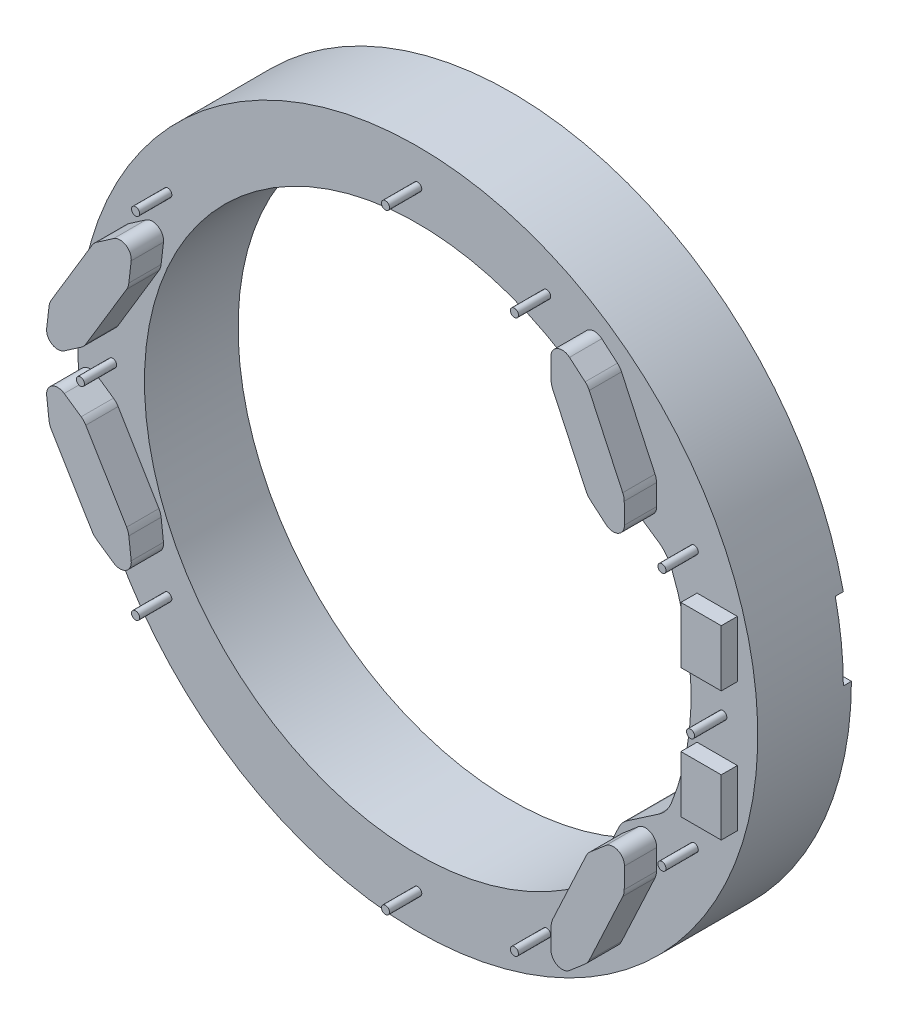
SolidWorks part; units mm, degrees
ref_plane "Front Plane" through (0, 0, 0) normal (0, 0, 1) x (1, 0, 0)
ref_plane "Top Plane" through (0, 0, 0) normal (0, 1, 0) x (1, 0, 0)
ref_plane "Right Plane" through (0, 0, 0) normal (1, 0, 0) x (0, 0, -1)
sketch "Sketch1" plane through (0, 0, 0) normal (0, 0, 1) x (1, 0, 0)
  line L0 (27.9645, -32.5157) -> (32.0997, -23.6476) construction
  line L1 (33.194, -22.3583) -> (38.1749, -18.9531) construction
  line L2 (27.9645, 32.5157) -> (32.0997, 23.6476) construction
  line L3 (33.194, 22.3583) -> (38.1749, 18.9531) construction
  line L4 (37.8927, 18.5404) -> (32.9118, 21.9456)
  line L5 (31.6466, 23.4363) -> (27.5113, 32.3044)
  line L6 (27.5113, -32.3044) -> (31.6466, -23.4363)
  line L7 (32.9118, -21.9456) -> (37.8927, -18.5404)
  line L32 (27.9645, -32.5157) -> (32.0997, -23.6476) construction
  line L33 (33.194, -22.3583) -> (38.1749, -18.9531) construction
  line L34 (38.1749, 18.9531) -> (33.194, 22.3583) construction
  line L35 (32.0997, 23.6476) -> (27.9645, 32.5157) construction
  circle A0 centre (0, 0) radius 53.5
  arc A1 (31.9213, -42.9335) -> (31.9213, 42.9335) centre (0, 0) ccw construction
  arc A2 (39.891, -16.0533) -> (39.891, 16.0533) centre (0, 0) ccw
  arc A3 (-10.1662, 42.2954) -> (-10.1662, -42.2954) centre (0, 0) ccw construction
  arc A4 (40.3548, -16.24) -> (40.3548, 16.24) centre (0, 0) ccw construction
  arc A5 (38.1749, -18.9531) -> (40.3548, -16.24) centre (34.7886, -14) ccw construction
  arc A6 (33.194, -22.3583) -> (32.0997, -23.6476) centre (34.9999, -25) ccw construction
  arc A7 (26.1309, -34.7768) -> (27.9645, -32.5157) centre (22.5266, -29.98) ccw construction
  arc A8 (40.3548, 16.24) -> (38.1749, 18.9531) centre (34.7886, 14) ccw construction
  arc A9 (32.0997, 23.6476) -> (33.194, 22.3583) centre (34.9999, 25) ccw construction
  arc A10 (27.9645, 32.5157) -> (26.1309, 34.7768) centre (22.5266, 29.98) ccw construction
  arc A11 (39.891, 16.0533) -> (37.8927, 18.5404) centre (34.7886, 14) ccw
  arc A12 (31.6466, 23.4363) -> (32.9118, 21.9456) centre (34.9999, 25) ccw
  arc A13 (27.5113, 32.3044) -> (25.8306, 34.3771) centre (22.5266, 29.98) ccw
  arc A14 (25.8306, 34.3771) -> (25.8306, -34.3771) centre (0, 0) ccw
  arc A15 (25.8306, -34.3771) -> (27.5113, -32.3044) centre (22.5266, -29.98) ccw
  arc A16 (32.9118, -21.9456) -> (31.6466, -23.4363) centre (34.9999, -25) ccw
  arc A17 (37.8927, -18.5404) -> (39.891, -16.0533) centre (34.7886, -14) ccw
  arc A73 (26.1309, -34.7768) -> (27.9645, -32.5157) centre (22.5266, -29.98) ccw construction
  arc A74 (33.194, -22.3583) -> (32.0997, -23.6476) centre (34.9999, -25) ccw construction
  arc A75 (38.1749, -18.9531) -> (40.3548, -16.24) centre (34.7886, -14) ccw construction
  arc A76 (40.3548, -16.24) -> (40.3548, 16.24) centre (0, 0) ccw construction
  arc A77 (40.3548, 16.24) -> (38.1749, 18.9531) centre (34.7886, 14) ccw construction
  arc A78 (32.0997, 23.6476) -> (33.194, 22.3583) centre (34.9999, 25) ccw construction
  arc A79 (27.9645, 32.5157) -> (26.1309, 34.7768) centre (22.5266, 29.98) ccw construction
  arc A80 (26.1309, 34.7768) -> (26.1309, -34.7768) centre (0, 0) ccw construction
  dimension "D1" = 0.5
extrude "Boss-Extrude1" add sketch "Sketch1" along normal blind 14.732
sketch "Sketch2" plane through (0, 0, 14.732) normal (0, 0, 1) x (1, 0, 0)
  line L0 (27.8049, 40.4297) -> (35.8347, 23.2099) construction
  line L1 (28.9564, 41.7727) -> (27.8049, 40.4297) construction
  line L2 (27.8049, 40.4297) -> (26.036, 40.4109) construction
  line L3 (-41.7614, 20.644) -> (-51.5471, 4.3579) construction
  line L4 (28.9564, 41.7727) -> (31.4147, 39.6649)
  line L5 (32.0634, 38.8101) -> (37.3313, 27.5131)
  line L6 (35.8347, 23.2099) -> (35.8347, 0) construction
  line L7 (35.8347, 0) -> (0, 0) construction
  line L8 (0, 0) -> (-51.5471, 0) construction
  line L9 (-51.5471, -4.3579) -> (-51.5471, 4.3579) construction
  line L10 (-51.5471, 4.3579) -> (-53.3044, 4.5615) construction
  line L11 (-46.6542, -12.501) -> (-43.9327, -10.8657) construction
  line L12 (-50.5423, -2.9019) -> (-51.5471, -4.3579) construction
  line L13 (-41.7614, -20.644) -> (-40.0041, -20.4404) construction
  line L14 (-42.7662, -22.1) -> (-41.7614, -20.644) construction
  line L15 (-46.6542, -12.501) -> (-49.3757, -14.1362) construction
  line L16 (-51.5471, -4.3579) -> (-53.3044, -4.5615) construction
  line L17 (-53.3044, 4.5615) -> (-52.9316, 7.7782)
  line L18 (-46.6542, 12.501) -> (-49.3757, 14.1362) construction
  line L19 (-52.5856, 8.794) -> (-46.1658, 19.4784)
  line L20 (-45.4313, 20.2607) -> (-42.7662, 22.1)
  line L21 (-42.7662, 22.1) -> (-41.7614, 20.644) construction
  line L22 (-41.7614, 20.644) -> (-40.0041, 20.4404) construction
  line L23 (-40.0041, 20.4404) -> (-40.3769, 17.2237)
  line L24 (-40.7228, 16.2079) -> (-47.1426, 5.5235)
  line L25 (-47.8771, 4.7412) -> (-50.5423, 2.9019)
  line L26 (-50.5423, 2.9019) -> (-51.5471, 4.3579) construction
  line L27 (-46.6542, 12.501) -> (-43.9327, 10.8657) construction
  line L28 (37.5691, 26.4668) -> (37.6036, 23.2287)
  line L29 (26.036, 40.4109) -> (26.0705, 37.1728)
  line L30 (26.3084, 36.1265) -> (31.5762, 24.8295)
  line L31 (32.2249, 23.9747) -> (34.6832, 21.8669)
  line L32 (35.8347, 23.2099) -> (37.6036, 23.2287) construction
  line L33 (35.8347, 23.2099) -> (34.6832, 21.8669) construction
  line L34 (31.8198, 31.8198) -> (34.6973, 33.1616) construction
  line L35 (31.8198, 31.8198) -> (28.9423, 30.478) construction
  line L36 (-41.7614, -20.644) -> (-51.5471, -4.3579) construction
  line L37 (-47.8771, -4.7412) -> (-50.5423, -2.9019)
  line L38 (-40.7228, -16.2079) -> (-47.1426, -5.5235)
  line L39 (-40.0041, -20.4404) -> (-40.3769, -17.2237)
  line L40 (-45.4313, -20.2607) -> (-42.7662, -22.1)
  line L41 (-52.5856, -8.794) -> (-46.1658, -19.4784)
  line L42 (-53.3044, -4.5615) -> (-52.9316, -7.7782)
  line L43 (31.8198, -31.8198) -> (28.9423, -30.478) construction
  line L44 (31.8198, -31.8198) -> (34.6973, -33.1616) construction
  line L45 (35.8347, -23.2099) -> (34.6832, -21.8669) construction
  line L46 (35.8347, -23.2099) -> (37.6036, -23.2287) construction
  line L47 (27.8049, -40.4297) -> (26.036, -40.4109) construction
  line L48 (28.9564, -41.7727) -> (27.8049, -40.4297) construction
  line L49 (27.8049, -40.4297) -> (35.8347, -23.2099) construction
  line L50 (32.2249, -23.9747) -> (34.6832, -21.8669)
  line L51 (26.3084, -36.1265) -> (31.5762, -24.8295)
  line L52 (26.036, -40.4109) -> (26.0705, -37.1728)
  line L53 (37.5691, -26.4668) -> (37.6036, -23.2287)
  line L54 (32.0634, -38.8101) -> (37.3313, -27.5131)
  line L55 (28.9564, -41.7727) -> (31.4147, -39.6649)
  arc A0 (28.9564, 41.7727) -> (26.036, 40.4109) centre (27.8049, 40.4297) ccw
  arc A1 (34.6832, 21.8669) -> (37.6036, 23.2287) centre (35.8347, 23.2099) ccw
  arc A2 (-40.0041, 20.4404) -> (-42.7662, 22.1) centre (-41.7614, 20.644) ccw
  arc A3 (-53.3044, 4.5615) -> (-50.5423, 2.9019) centre (-51.5471, 4.3579) ccw
  circle A4 centre (0, 0) radius 53.5 construction
  arc A6 (-52.9316, 7.7782) -> (-52.5856, 8.794) centre (-50.4084, 7.4858) cw
  arc A10 (-46.1658, -19.4784) -> (-45.4313, -20.2607) centre (-43.9886, -18.1702) ccw
  arc A11 (-40.3769, -17.2237) -> (-40.7228, -16.2079) centre (-42.9, -17.5161) ccw
  arc A12 (-47.1426, -5.5235) -> (-47.8771, -4.7412) centre (-49.3198, -6.8317) ccw
  arc A13 (-52.9316, -7.7782) -> (-52.5856, -8.794) centre (-50.4084, -7.4858) ccw
  arc A14 (-47.1426, 5.5235) -> (-47.8771, 4.7412) centre (-49.3198, 6.8317) cw
  arc A15 (-40.3769, 17.2237) -> (-40.7228, 16.2079) centre (-42.9, 17.5161) cw
  arc A16 (-46.1658, 19.4784) -> (-45.4313, 20.2607) centre (-43.9886, 18.1702) cw
  arc A17 (31.4147, 39.6649) -> (32.0634, 38.8101) centre (29.7614, 37.7366) cw
  arc A18 (37.3313, 27.5131) -> (37.5691, 26.4668) centre (35.0292, 26.4397) cw
  arc A19 (31.5762, 24.8295) -> (32.2249, 23.9747) centre (33.8782, 25.903) ccw
  arc A20 (26.0705, 37.1728) -> (26.3084, 36.1265) centre (28.6104, 37.1999) ccw
  arc A21 (-53.3044, -4.5615) -> (-50.5423, -2.9019) centre (-51.5471, -4.3579) cw
  arc A22 (-40.0041, -20.4404) -> (-42.7662, -22.1) centre (-41.7614, -20.644) cw
  arc A23 (26.0705, -37.1728) -> (26.3084, -36.1265) centre (28.6104, -37.1999) cw
  arc A24 (31.5762, -24.8295) -> (32.2249, -23.9747) centre (33.8782, -25.903) cw
  arc A25 (37.3313, -27.5131) -> (37.5691, -26.4668) centre (35.0292, -26.4397) ccw
  arc A26 (31.4147, -39.6649) -> (32.0634, -38.8101) centre (29.7614, -37.7366) ccw
  arc A27 (34.6832, -21.8669) -> (37.6036, -23.2287) centre (35.8347, -23.2099) cw
  arc A28 (28.9564, -41.7727) -> (26.036, -40.4109) centre (27.8049, -40.4297) cw
  circle A29 centre (27.8049, 40.4297) radius 0.55 construction
  circle A30 centre (35.8347, 23.2099) radius 0.55 construction
  circle A31 centre (-51.5471, 4.3579) radius 0.55 construction
  circle A32 centre (-41.7614, 20.644) radius 0.55 construction
  circle A33 centre (48, 0) radius 0.635
  circle A34 centre (43.5028, 20.2857) radius 0.635
  circle A35 centre (20.2857, 43.5028) radius 0.635
  circle A36 centre (0, 48) radius 0.635
  circle A37 centre (-39.3193, 27.5317) radius 0.635
  circle A38 centre (-48, 0) radius 0.635
  circle A39 centre (43.5028, -20.2857) radius 0.635
  circle A43 centre (20.2857, -43.5028) radius 0.635
  circle A44 centre (0, -48) radius 0.635
  circle A45 centre (-39.3193, -27.5317) radius 0.635
  point P2 (31.8198, 31.8198)
  point P9 (-46.6542, 12.501)
  dimension "D2" = 2.54
  dimension "D3" = 2.54
  dimension "D5" = 1.27
  dimension "D1" = 6.35
  dimension "D4" = 6.35
extrude "Boss-Extrude2" add sketch "Sketch2" along normal blind 5.08
ref_plane "Plane1" through (0, 0, 0) normal (0, 1, 0) x (1, 0, 0)
sketch "Sketch4" plane through (0, 0, 14.732) normal (0, 0, 1) x (1, 0, 0)
  line L0 (43.942, 5.715) -> (43.942, -5.715) construction
  line L1 (50.292, -14.605) -> (43.942, -14.605)
  line L2 (50.292, -14.605) -> (50.292, -5.715)
  line L3 (50.292, -5.715) -> (43.942, -5.715)
  line L4 (43.942, -14.605) -> (43.942, -5.715)
  line L5 (50.292, 5.715) -> (43.942, 5.715)
  line L6 (50.292, 5.715) -> (50.292, 14.605)
  line L7 (50.292, 14.605) -> (43.942, 14.605)
  line L8 (43.942, 5.715) -> (43.942, 14.605)
  line L9 (43.942, 0) -> (0, 0) construction
  dimension "D1" = 43.942
  dimension "D2" = 11.43
  dimension "D3" = 8.89
  dimension "D4" = 6.35
extrude "Boss-Extrude3" add sketch "Sketch4" along normal blind 2.54
sketch "Sketch3" plane through (0, 0, 0) normal (0, 0, -1) x (-1, 0, 0)
  line L1 (0, 0) -> (-68.3045, 0)
  line L2 (0, 0) -> (0, 11.5784)
  line L3 (0, 11.5784) -> (-68.3045, 11.5784)
  line L4 (-68.3045, 0) -> (-68.3045, 11.5784)
extrude "Cut-Extrude1" cut sketch "Sketch3" against normal blind 1.27
